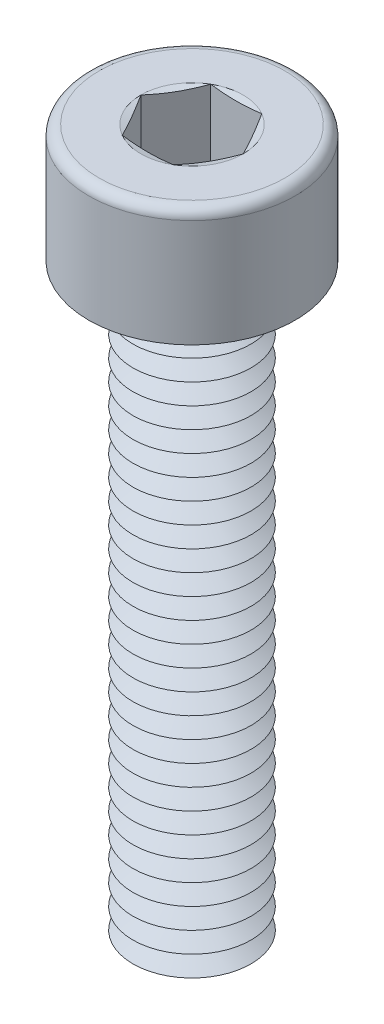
SolidWorks part; units mm, degrees
ref_plane "Front Plane" through (0, 0, 0) normal (0, 0, 1) x (1, 0, 0)
ref_plane "Top Plane" through (0, 0, 0) normal (0, 1, 0) x (1, 0, 0)
ref_plane "Right Plane" through (0, 0, 0) normal (1, 0, 0) x (0, 0, -1)
sketch "Sketch1" plane through (0, 0, 0) normal (0, 1, 0) x (1, 0, 0)
  circle A0 centre (0, 0) radius 2
  dimension "D1" = 4
extrude "Extrude1" add sketch "Sketch1" along normal blind 20
sketch "Sketch2" plane through (0, 20, 0) normal (0, 1, 0) x (1, 0, 0)
  circle A0 centre (0, 0) radius 3.5
  dimension "D1" = 7
extrude "Extrude2" add sketch "Sketch2" along normal blind 4
sketch "Sketch3" plane through (0, 24, 0) normal (0, 1, 0) x (1, 0, 0)
  line L1 (0.866, 1.5) -> (-0.866, 1.5)
  line L2 (-0.866, 1.5) -> (-1.7321, 0)
  line L3 (-1.7321, 0) -> (-0.866, -1.5)
  line L4 (-0.866, -1.5) -> (0.866, -1.5)
  line L5 (0.866, -1.5) -> (1.7321, 0)
  line L6 (1.7321, 0) -> (0.866, 1.5)
  circle A0 centre (0, 0) radius 1.5 construction
  dimension "D1" = 3
extrude "Extrude3" cut sketch "Sketch3" against normal blind 3
fillet "Fillet1" radius 0.35 1 edges at (0, 24, 3.5)
sketch "Sketch4" plane through (0, 0, 0) normal (1, 0, 0) x (0, 0, -1)
  line L0 (-1.5, 21) -> (0, 21)
  line L1 (0, 21) -> (0, 20.134)
  line L2 (0, 20.134) -> (-1.5, 21)
  dimension "D1" = 30
revolve "Cut-Revolve1" cut sketch "Sketch4" angle 360 about L1
sketch "Sketch5" plane through (0, 0, 0) normal (0, 0, 1) x (1, 0, 0)
  line L0 (-2, 0.35) -> (-2, -0.35)
  line L1 (-2, 20) -> (-2, 0) construction
  line L2 (-2, -0.35) -> (-1.3938, 0)
  line L3 (-2, 0) -> (2, 0) construction
  line L4 (-1.3938, 0) -> (-2, 0.35)
  dimension "D1" = 0.7
revolve "Cut-Revolve2" cut sketch "Sketch5" angle 360 about axis through (0, 20, 0) along (0, -1, 0)
pattern_linear "LPattern1" count 29 spacing 0.7 along (0, 1, 0) of "Cut-Revolve2"
sketch "Sketch6" plane through (0, 24, 0) normal (0, 1, 0) x (1, 0, 0)
  circle A0 centre (0, 0) radius 1.7321
extrude "Extrude4" cut sketch "Sketch6" against normal through all draft 75
